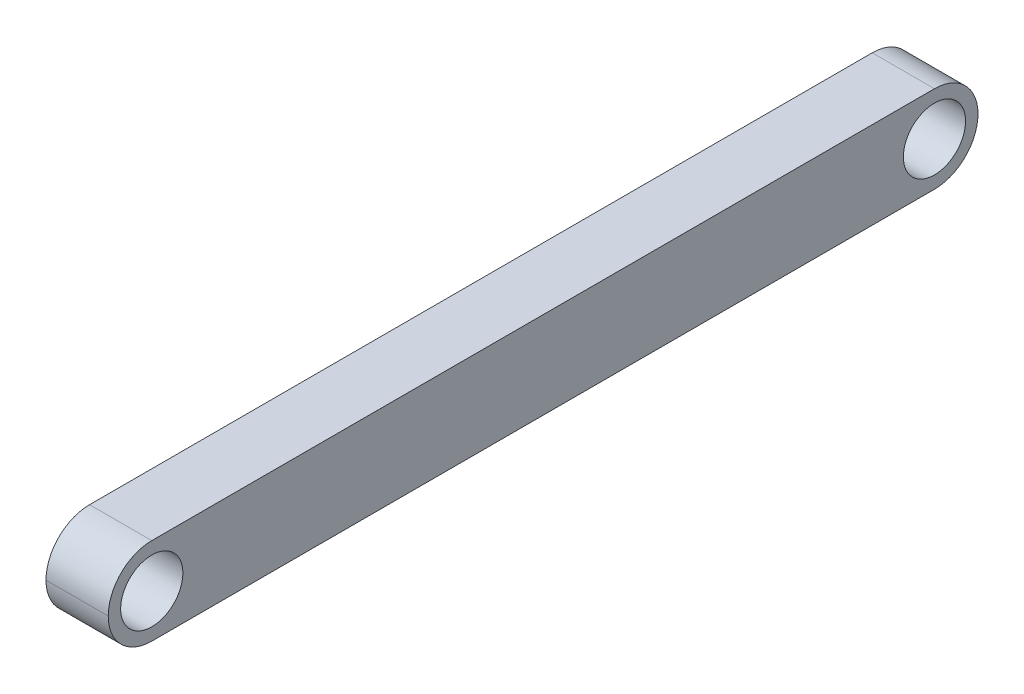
SolidWorks part; units mm, degrees
ref_plane "Ebene vorne" through (0, 0, 0) normal (0, 0, 1) x (1, 0, 0)
ref_plane "Ebene oben" through (0, 0, 0) normal (0, 1, 0) x (1, 0, 0)
ref_plane "Ebene rechts" through (0, 0, 0) normal (1, 0, 0) x (0, 0, -1)
sketch "Skizze1" plane through (0, 0, 0) normal (1, 0, 0) x (0, 0, -1)
  line L0 (0, 0) -> (629, 0) construction
  line L2 (664, 35) -> (-35, 35)
  line L3 (664, 35) -> (664, -35)
  line L4 (664, -35) -> (-35, -35)
  line L5 (-35, 35) -> (-35, -35)
  line L6 (664, 35) -> (-35, -35) construction
  line L7 (664, -35) -> (-35, 35) construction
  circle A0 centre (0, 0) radius 25
  circle A1 centre (629, 0) radius 25
  point P0 (314.5, 0)
  dimension "D1" = 50
  dimension "D2" = 629
  dimension "D3" = 70
  dimension "D4" = 35
extrude "Aufsatz-Linear austragen1" add sketch "Skizze1" along normal mid plane 50
fillet "Verrundung1" radius 35 4 edges at (0, -35, 35) (0, 35, 35) (0, -35, -664) (0, 35, -664)
